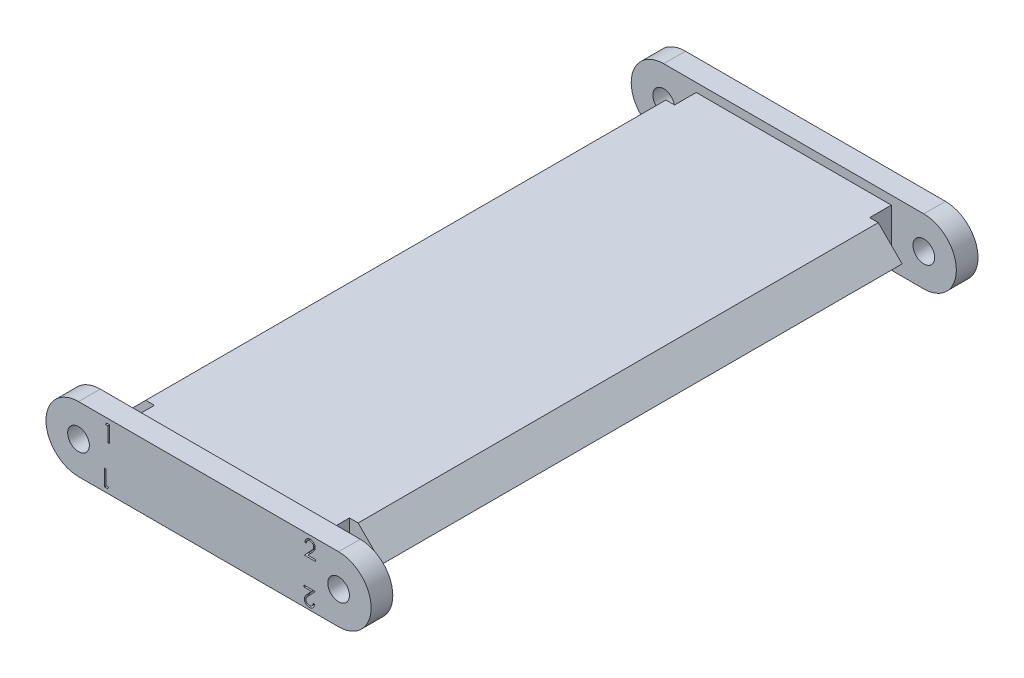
SolidWorks part; units mm, degrees
ref_plane "Plane1" through (0, 0, 0) normal (0, 0, 1) x (1, 0, 0)
ref_plane "Plane2" through (0, 0, 0) normal (0, 1, 0) x (1, 0, 0)
ref_plane "Plane3" through (0, 0, 0) normal (1, 0, 0) x (0, 0, -1)
sketch "Sketch1" plane through (0, 0, 0) normal (0, 0, 1) x (1, 0, 0)
  line L1 (-76.2, 19.05) -> (76.2, 19.05)
  line L3 (-76.2, -19.05) -> (76.2, -19.05)
  arc A0 (76.2, 19.05) -> (76.2, -19.05) centre (76.2, 0) cw
  arc A1 (-76.2, -19.05) -> (-76.2, 19.05) centre (-76.2, 0) cw
  point P6 (0, -19.05)
  dimension "D1" = 152.4
  dimension "D2" = 19.05
extrude "Base-Extrude" add sketch "Sketch1" along normal blind 12.7
sketch "Sketch2" plane through (0, 0, 12.7) normal (0, 0, 1) x (1, 0, 0)
  circle A0 centre (76.2, 0) radius 6.35
  circle A1 centre (-76.2, 0) radius 6.35
  dimension "D1" = 12.7
sketch "Sketch4" plane through (0, 0, 0) normal (0, 0, -1) x (-1, 0, 0)
  line L0 (-76.2, 19.05) -> (76.2, 19.05) construction
  line L1 (76.2, -13.97) -> (-76.2, -13.97)
  line L2 (76.2, -13.97) -> (76.2, 13.97)
  line L3 (76.2, 13.97) -> (-76.2, 13.97)
  line L4 (-76.2, -13.97) -> (-76.2, 13.97)
  line L5 (76.2, -19.05) -> (-76.2, -19.05) construction
  dimension "D3" = 5.08
  dimension "D4" = 5.08
extrude "Boss-Extrude2" add sketch "Sketch4" along normal blind 330.2
sketch "Sketch6" plane through (4.8861, -2.859, -330.2) normal (0, 0, -1) x (-1, 0, 0)
  line L1 (-71.3139, 21.909) -> (81.0861, 21.909)
  line L3 (-71.3139, -16.191) -> (81.0861, -16.191)
  arc A0 (81.0861, 21.909) -> (81.0861, -16.191) centre (81.0861, 2.859) cw
  arc A1 (-71.3139, -16.191) -> (-71.3139, 21.909) centre (-71.3139, 2.859) cw
  arc A2 (81.0861, -16.191) -> (81.0861, 21.909) centre (81.0861, 2.859) ccw construction
  point P6 (4.8861, -16.191)
  dimension "D1" = 152.4
  dimension "D2" = 19.05
extrude "Boss-Extrude3" add sketch "Sketch6" along normal blind 12.7
sketch "Sketch7" plane through (67.1637, -3.0467, -342.9) normal (0, 0, -1) x (-1, 0, 0)
  circle A0 centre (143.3637, 3.0467) radius 6.35
  circle A1 centre (-9.0363, 3.0467) radius 6.35
  arc A4 (143.3637, -16.0033) -> (143.3637, 22.0967) centre (143.3637, 3.0467) ccw construction
  arc A5 (-9.0363, 22.0967) -> (-9.0363, -16.0033) centre (-9.0363, 3.0467) ccw construction
  dimension "D1" = 12.7
chamfer "Chamfer2" distance 13.97 angle 45 8 edges at (-76.2, 0, 0) (-76.2, -13.97, -165.1) (-76.2, 13.97, -165.1) (76.2, 0, 0) (76.2, 13.97, -165.1) (76.2, -13.97, -165.1) (-76.2, 0, -330.2) (76.2, 0, -330.2)
sketch "Sketch8" plane through (0, 13.97, 0) normal (0, 1, 0) x (-1, 0, 0)
  line L0 (-76.2, 0) -> (76.2, 0) construction
  line L1 (-129.3881, -330.2) -> (-57.15, -330.2)
  line L2 (-129.3881, -330.2) -> (-129.3881, 0)
  line L3 (-129.3881, 0) -> (-57.15, 0)
  line L4 (-57.15, -330.2) -> (-57.15, -317.5)
  line L6 (-57.15, -12.7) -> (-57.15, 0)
  line L7 (-57.15, -12.7) -> (-101.6, -12.7)
  line L8 (76.2, -330.2) -> (-76.2, -330.2) construction
  line L9 (-57.15, -317.5) -> (-101.6, -317.5)
  line L10 (-101.6, -12.7) -> (-101.6, -317.5)
  dimension "D1" = 19.05
  dimension "D2" = 27.7881
  dimension "D3" = 25.4
  dimension "D4" = 12.7
extrude "Cut-Extrude1" cut sketch "Sketch8" against normal through all
mirror "Mirror1" about plane through (0, 0, 0) normal (1, 0, 0) of "Cut-Extrude1"
extrude "Cut-Extrude2" cut sketch "Sketch2" against normal up to surface (12.7 mm away)
extrude "Cut-Extrude3" cut sketch "Sketch7" against normal up to surface (12.7 mm away)
ref_plane "Plane4" through (0, 0, -165.1) normal (0, 0, 1) x (1, 0, 0)
sketch "Sketch9" plane through (0, 0, -330.2) normal (0, 0, 1) x (1, 0, 0)
  circle A0 centre (76.2, 0) radius 6.35 construction
  circle A1 centre (-76.2, 0) radius 6.35 construction
  point P0 (-76.2, 0)
  point P1 (76.2, 0)
sketch "Sketch10" plane through (0, 0, 0) normal (0, 0, -1) x (-1, 0, 0)
  circle A0 centre (76.2, 0) radius 6.35 construction
  circle A1 centre (-76.2, 0) radius 6.35 construction
  point P0 (76.2, 0)
  point P1 (-76.2, 0)
sketch "Sketch11" plane through (0, 0, 12.7) normal (0, 0, 1) x (1, 0, 0)
  text T0 "1" font "Century Gothic" height in points 36
  text T1 "<r180>1</r>" font "Century Gothic" height in points 36
  text T2 "2" font "Century Gothic" height in points 36
  text T3 "<r180>2</r>" font "Century Gothic" height in points 36
extrude "Cut-Extrude4" cut sketch "Sketch11" against normal blind 2.54
sketch "Sketch12" plane through (0, 0, -342.9) normal (0, 0, -1) x (-1, 0, 0)
  text T0 "1" font "Century Gothic" height in points 36
  text T1 "<r180>1</r>" font "Century Gothic" height in points 36
  text T2 "2" font "Century Gothic" height in points 36
  text T3 "<r180>2</r>" font "Century Gothic" height in points 36
extrude "Cut-Extrude5" cut sketch "Sketch12" against normal blind 2.54
sketch "Sketch13" plane through (0, 0, -330.2) normal (0, 0, 1) x (1, 0, 0)
  point P0 (76.2, 0)
